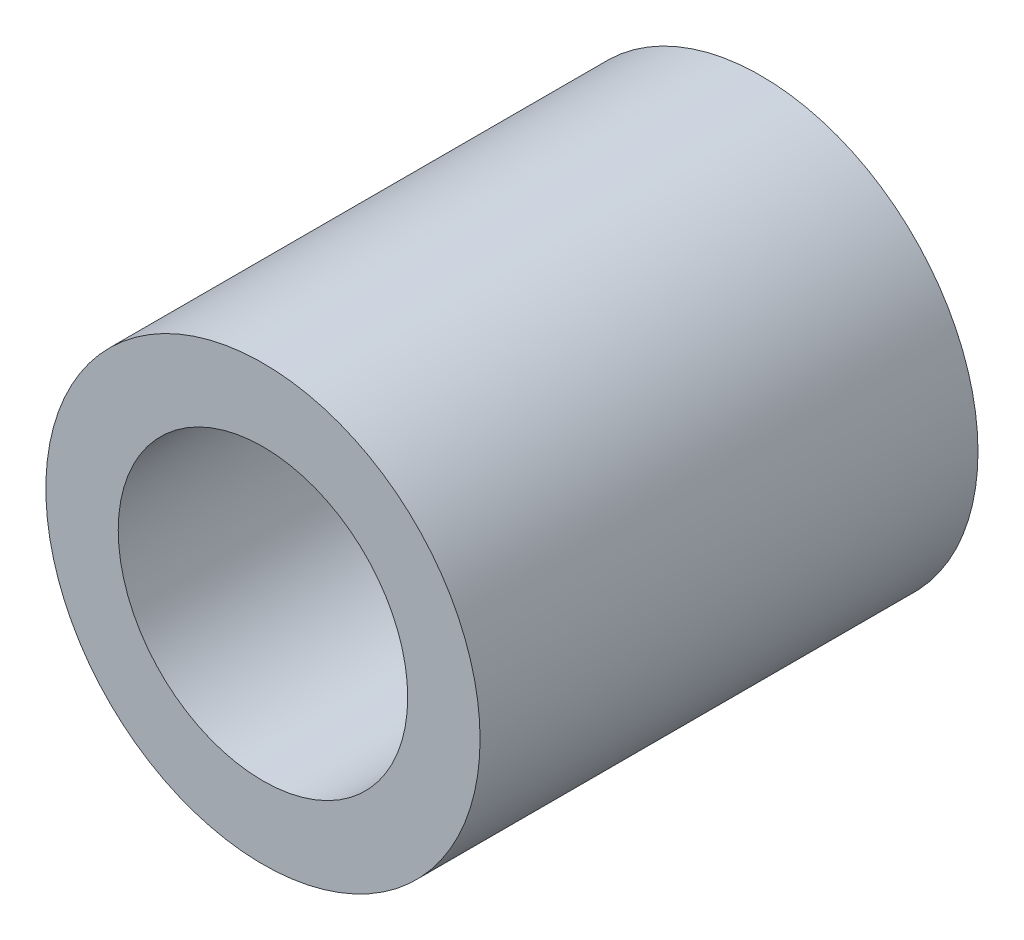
SolidWorks part; units mm, degrees
ref_plane "Front" through (0, 0, 0) normal (0, 0, 1) x (1, 0, 0)
ref_plane "Top" through (0, 0, 0) normal (0, 1, 0) x (1, 0, 0)
ref_plane "Right" through (0, 0, 0) normal (1, 0, 0) x (0, 0, -1)
sketch "Sketch1" plane through (0, 0, 0) normal (0, 0, 1) x (1, 0, 0)
  circle A0 centre (0, 0) radius 4.7625
  circle A1 centre (0, 0) radius 3.175
  dimension "D1" = 9.525
  dimension "D2" = 6.35
extrude "Boss-Extrude1" add sketch "Sketch1" along normal blind 10.922
